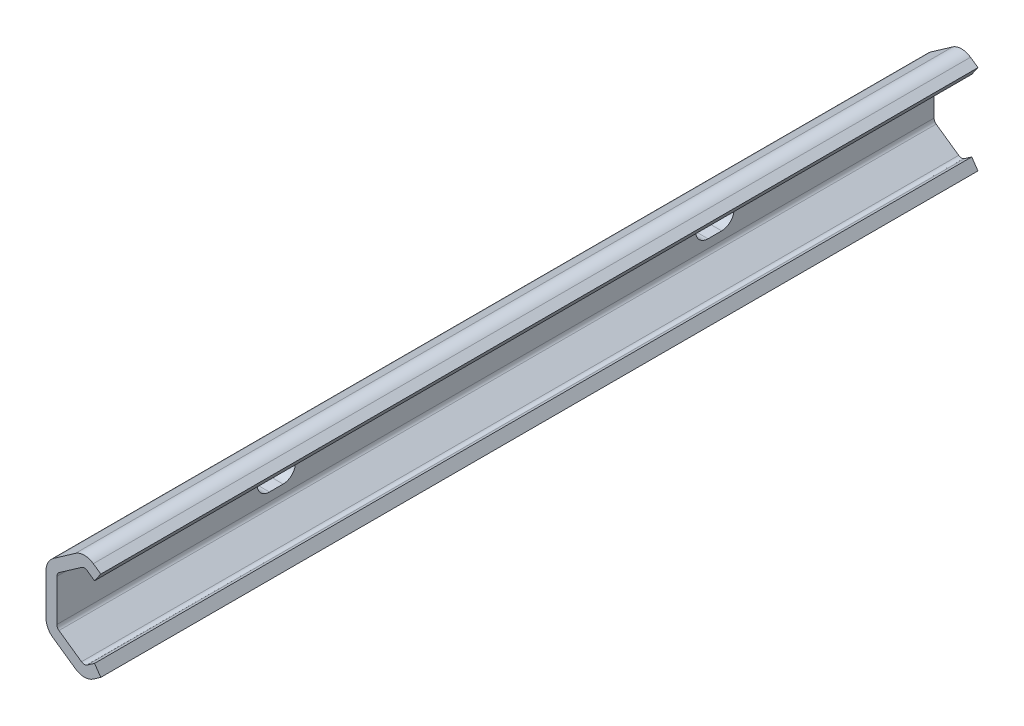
SolidWorks part; units mm, degrees
ref_plane "Front Plane" through (0, 0, 0) normal (0, 0, 1) x (1, 0, 0)
ref_plane "Top Plane" through (0, 0, 0) normal (0, 1, 0) x (1, 0, 0)
ref_plane "Right Plane" through (0, 0, 0) normal (1, 0, 0) x (0, 0, -1)
sketch "Sketch1" plane through (0, 0, 0) normal (0, 0, 1) x (1, 0, 0)
  line L0 (8.8528, 6.5211) -> (10, 8.1594)
  line L1 (10, 8.1594) -> (8.6321, 9.1172)
  line L2 (5.3679, 9.1172) -> (1.3827, 6.3267)
  line L3 (0, 3.8) -> (0, -3.8)
  line L4 (1.3827, -6.3267) -> (5.3679, -9.1172)
  line L5 (8.6321, -9.1172) -> (10, -8.1594)
  line L6 (10, -8.1594) -> (8.8528, -6.5211)
  line L7 (8.8528, -6.5211) -> (7.522, -7.453)
  line L8 (6.478, -7.453) -> (2.3691, -4.5758)
  line L9 (2, -3.8) -> (2, 3.8)
  line L10 (2.3691, 4.5758) -> (6.478, 7.453)
  line L12 (7.522, 7.453) -> (8.8528, 6.5211)
  arc A0 (8.6321, 9.1172) -> (5.3679, 9.1172) centre (7, 6.7863) ccw
  arc A1 (1.3827, 6.3267) -> (0, 3.8) centre (3.2464, 3.6652) ccw
  arc A2 (0, -3.8) -> (1.3827, -6.3267) centre (3, -3.8) ccw
  arc A3 (5.3679, -9.1172) -> (8.6321, -9.1172) centre (7, -6.7863) ccw
  arc A4 (7.522, -7.453) -> (6.478, -7.453) centre (7, -6.7075) cw
  arc A5 (2.3691, -4.5758) -> (2, -3.8) centre (2.8685, -3.8626) cw
  arc A6 (2, 3.8) -> (2.3691, 4.5758) centre (3, 3.8) cw
  arc A7 (6.478, 7.453) -> (7.522, 7.453) centre (7, 6.7075) cw
  dimension "D1" = 2.8455
  dimension "D2" = 3.2492
  dimension "D3" = 3
  dimension "D4" = 2.8455
  dimension "D5" = 0.91
  dimension "D6" = 0.8708
  dimension "D7" = 1
  dimension "D8" = 0.91
  dimension "D9" = 1.3827
  dimension "D10" = 1.3827
  dimension "D11" = 2
  dimension "D12" = 2.3691
  dimension "D13" = 2.8685
  dimension "D14" = 2.3691
  dimension "D15" = 3.2464
  dimension "D16" = 5.3679
  dimension "D17" = 3
  dimension "D18" = 5.3679
  dimension "D19" = 6.478
  dimension "D20" = 6.478
  dimension "D21" = 7
  dimension "D22" = 7.522
  dimension "D23" = 3.6652
  dimension "D24" = 3.8
  dimension "D31" = 8.8528
  dimension "D32" = 8.8528
  dimension "D33" = 10
  dimension "D34" = 10
extrude "Extrude1" add sketch "Sketch1" against normal blind 160
sketch "Sketch2" plane through (2, 0, 0) normal (1, 0, 0) x (0, 0, -1)
  line L0 (38.75, 0) -> (41.25, 0) construction
  line L1 (38.75, 2.25) -> (41.25, 2.25)
  line L2 (38.75, -2.25) -> (41.25, -2.25)
  arc A0 (38.75, 2.25) -> (38.75, -2.25) centre (38.75, 0) ccw
  arc A1 (41.25, -2.25) -> (41.25, 2.25) centre (41.25, 0) ccw
  point P6 (40, 0)
  dimension "D1" = 2.5
  dimension "D2" = 4.5
  dimension "D3" = 40
extrude "Extrude2" cut sketch "Sketch2" against normal through all
pattern_linear "LPattern1" count 2 spacing 80 along (0, 0, -1) of "Extrude2"
